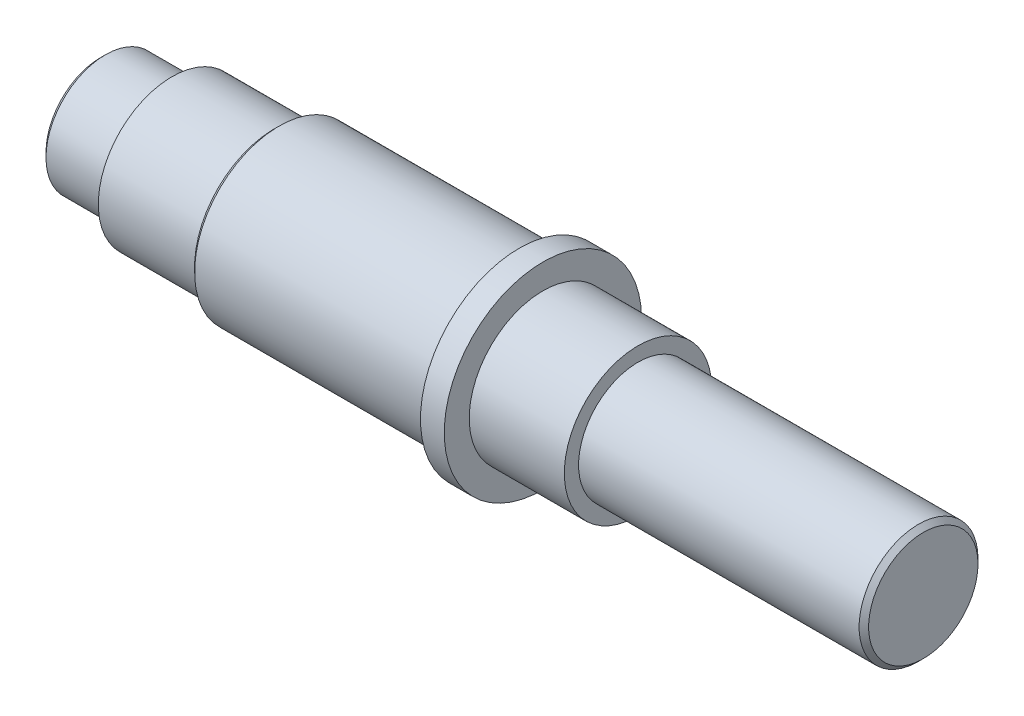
SolidWorks part; units mm, degrees
ref_plane "Přední rovina" through (0, 0, 0) normal (0, 0, 1) x (1, 0, 0)
ref_plane "Horní rovina" through (0, 0, 0) normal (0, 1, 0) x (1, 0, 0)
ref_plane "Pravá rovina" through (0, 0, 0) normal (1, 0, 0) x (0, 0, -1)
sketch "Skica1" plane through (0, 0, 0) normal (0, 0, 1) x (1, 0, 0)
  line L0 (200, 0) -> (-200, 0) construction
  line L1 (48.25, 15.5) -> (48.25, 0)
  line L3 (-28.25, 17.75) -> (23.25, 17.75)
  line L4 (23.25, 17.75) -> (23.25, 0)
  line L6 (-64.75, 0) -> (-49.75, 0)
  line L7 (-28.25, 0) -> (-28.25, 15.5)
  line L8 (28.25, 20.75) -> (23.25, 20.75)
  line L9 (23.25, 20.75) -> (23.25, 17.75)
  line L10 (-28.25, 15.5) -> (-49.75, 15.5)
  line L11 (-49.75, 0) -> (-49.75, 12.5)
  line L12 (-28.25, 0) -> (-49.75, 0)
  line L13 (48.25, 15.5) -> (28.25, 15.5)
  line L14 (-49.75, 12.5) -> (-64.75, 12.5)
  line L15 (108.25, 0) -> (108.25, 12.5)
  line L16 (108.25, 12.5) -> (48.25, 12.5)
  line L17 (-49.75, 15.5) -> (-49.75, 12.5)
  line L18 (-28.25, 17.75) -> (-28.25, 15.5)
  line L19 (-64.75, 12.5) -> (-64.75, 0)
  line L20 (-28.25, 0) -> (23.25, 0)
  line L21 (28.25, 0) -> (23.25, 0)
  line L22 (28.25, 0) -> (48.25, 0)
  line L23 (48.25, 0) -> (108.25, 0)
  line L25 (0, 0) -> (0, 30) construction
  line L26 (28.25, 0) -> (28.25, 20.75)
  dimension "D1" = 12.5
  dimension "D2" = 15.5
  dimension "D3" = 20.75
  dimension "D4" = 17.75
  dimension "D5" = 21.5
  dimension "D6" = 15.5
  dimension "D7" = 15
  dimension "D8" = 12.5
  dimension "D9" = 51.5
  dimension "D10" = 5
  dimension "D11" = 20
  dimension "D12" = 60
revolve "Rotovat8" add sketch "Skica1" angle 360 about L0
chamfer "Zkosení1" distance 1 angle 45 3 edges at (108.25, 0, -12.5) (-64.75, 0, -12.5) (-28.25, 0, -17.75)
